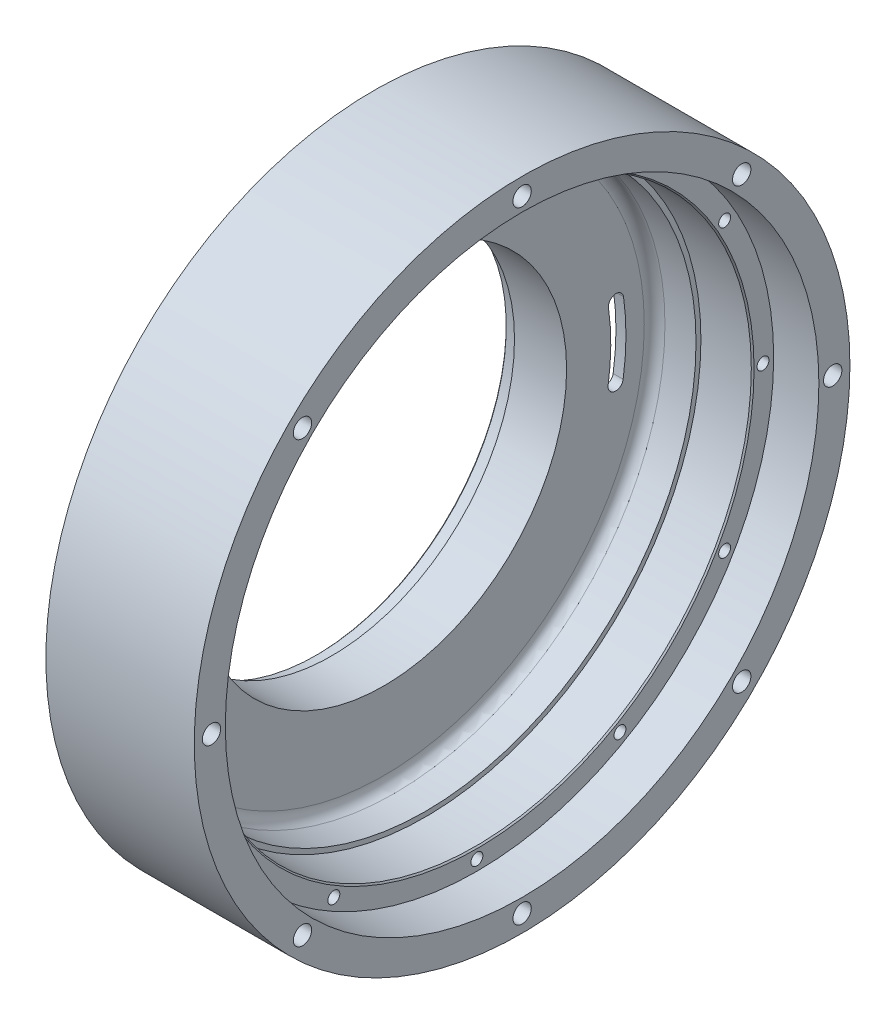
SolidWorks part; units mm, degrees
ref_plane "Front Plane" through (0, 0, 0) normal (0, 0, 1) x (1, 0, 0)
ref_plane "Top Plane" through (0, 0, 0) normal (0, 1, 0) x (1, 0, 0)
ref_plane "Right Plane" through (0, 0, 0) normal (1, 0, 0) x (0, 0, -1)
sketch "Sketch1" plane through (0, 0, 0) normal (1, 0, 0) x (0, 0, -1)
  circle A0 centre (0, 0) radius 120.65
  dimension "D1" = 241.3
extrude "Boss-Extrude1" add sketch "Sketch1" along normal blind 54.61
sketch "Sketch2" plane through (54.61, 0, 0) normal (1, 0, 0) x (0, 0, -1)
  circle A0 centre (0, 0) radius 67.31
  dimension "D1" = 134.62
extrude "Cut-Extrude1" cut sketch "Sketch2" against normal through all
sketch "Sketch3" plane through (54.61, 0, 0) normal (1, 0, 0) x (0, 0, -1)
  circle A0 centre (0, 0) radius 99.695
  dimension "D1" = 199.39
extrude "Cut-Extrude2" cut sketch "Sketch3" against normal blind 50.927
sketch "Sketch4" plane through (54.61, 0, 0) normal (1, 0, 0) x (0, 0, -1)
  circle A0 centre (0, 0) radius 101.4984
  dimension "D1" = 202.9968
extrude "Cut-Extrude3" cut sketch "Sketch4" against normal blind 35.687
sketch "Sketch5" plane through (54.61, 0, 0) normal (1, 0, 0) x (0, 0, -1)
  circle A0 centre (0, 0) radius 109.22
extrude "Cut-Extrude4" cut sketch "Sketch5" against normal blind 16.637
hole_wizard "Tapped Hole for #8-32 Helicoil1" positions "Sketch8" profile "Sketch9" tap size "#8-32" standard "Helicoil® Inch"
sketch "Sketch8" plane through (37.973, 0, 0) normal (1, 0, 0) x (0, 0, -1)
  point P0 (0, 105.283)
  point P4 (0, 105.283)
  dimension "D1" = 105.283
sketch "Sketch9" plane through (37.973, 105.283, 0) normal (0, 1, 0) x (0, 0, -1)
  line L0 (0, 0) -> (0, 16.8396)
  line L1 (0, 16.8396) -> (2.1971, 15.5194)
  line L2 (2.1971, 15.5194) -> (2.1971, 0)
  line L5 (2.1971, 0) -> (0, 0)
  line L10 (0, 16.8396) -> (-2.1971, 15.5194) construction
  line L11 (0, -6.35) -> (0, 107.95) construction
  dimension "Tap Drill Dia." = 4.3942
  dimension "Tap Drill Depth" = 15.5194
  dimension "Drill Angle" = 118
pattern_circular "CirPattern1" count 12 over 360 about axis through (0, 0, 0) along (1, 0, 0) of "Tapped Hole for #8-32 Helicoil1"
sketch "Sketch10" plane through (0, 0, 0) normal (-1, 0, 0) x (0, 0, 1)
  circle A0 centre (0, 0) radius 76.2
  dimension "D1" = 152.4
extrude "Boss-Extrude2" add sketch "Sketch10" along normal blind 21.59
sketch "Sketch11" plane through (-21.59, 0, 0) normal (-1, 0, 0) x (0, 0, 1)
  circle A0 centre (0, 0) radius 67.31
  dimension "D1" = 134.62
extrude "Cut-Extrude5" cut sketch "Sketch11" against normal through all
sketch "Sketch12" plane through (-21.59, 0, 0) normal (-1, 0, 0) x (0, 0, 1)
  circle A0 centre (0, 0) radius 69.8627
  dimension "D1" = 139.7254
extrude "Cut-Extrude6" cut sketch "Sketch12" against normal blind 6.096
hole_wizard "Tapped Hole for #8-32 Helicoil2" positions "Sketch13" profile "Sketch14" tap size "#8-32" standard "Helicoil® Inch"
sketch "Sketch13" plane through (-21.59, 0, 0) normal (-1, 0, 0) x (0, 0, 1)
  circle A0 centre (0, 0) radius 67.31 construction
  point P0 (0, 72.898)
  point P5 (0, 72.898)
  point P7 (0, 72.898)
  point P11 (0, 72.898)
  point P13 (0, 72.898)
  point P15 (0, 72.898)
  dimension "D1" = 72.898
sketch "Sketch14" plane through (-21.59, 72.898, 0) normal (0, 1, 0) x (0, 0, 1)
  line L0 (0, 0) -> (0, 16.8396)
  line L1 (0, 16.8396) -> (2.1971, 15.5194)
  line L2 (2.1971, 15.5194) -> (2.1971, 0)
  line L5 (2.1971, 0) -> (0, 0)
  line L10 (0, 16.8396) -> (-2.1971, 15.5194) construction
  line L11 (0, -6.35) -> (0, 107.95) construction
  dimension "Tap Drill Dia." = 4.3942
  dimension "Tap Drill Depth" = 15.5194
  dimension "Drill Angle" = 118
pattern_circular "CirPattern2" count 8 over 360 about axis through (0, 0, 0) along (1, 0, 0) of "Tapped Hole for #8-32 Helicoil2"
sketch "Sketch16" plane through (0, 0, 0) normal (-1, 0, 0) x (0, 0, 1)
  arc A0 (-85.3519, -13.1568) -> (-85.4877, 12.2432) centre (0, 0) cw construction
  arc A1 (-88.2535, 12.6393) -> (-88.1133, -13.5824) centre (0, 0) ccw
  arc A2 (-82.722, 11.8471) -> (-82.5905, -12.7311) centre (0, 0) ccw
  arc A3 (-82.722, 11.8471) -> (-88.2535, 12.6393) centre (-85.4877, 12.2432) ccw
  arc A4 (-88.1133, -13.5824) -> (-82.5905, -12.7311) centre (-85.3519, -13.1568) ccw
  point P4 (-86.3588, -0.4618)
  dimension "D1" = 86.36
  dimension "D2" = 83.566
  dimension "D3" = 25.4
extrude "Cut-Extrude7" cut sketch "Sketch16" against normal through all
hole_wizard "Tapped Hole for 1/4-20 Helicoil1" positions "Sketch17" profile "Sketch18" tap size "1/4-20" standard "Helicoil® Inch"
sketch "Sketch17" plane through (54.61, 0, 0) normal (1, 0, 0) x (0, 0, -1)
  point P0 (114.3, 0)
  dimension "D1" = 114.3
sketch "Sketch18" plane through (54.61, 0, -114.3) normal (0, 1, 0) x (0, 0, -1)
  line L0 (0, 0) -> (0, 25.9312)
  line L1 (0, 25.9312) -> (3.3782, 23.9014)
  line L2 (3.3782, 23.9014) -> (3.3782, 0)
  line L5 (3.3782, 0) -> (0, 0)
  line L10 (0, 25.9312) -> (-3.3782, 23.9014) construction
  line L11 (0, -6.35) -> (0, 107.95) construction
  dimension "Tap Drill Dia." = 6.7564
  dimension "Tap Drill Depth" = 23.9014
  dimension "Drill Angle" = 118
pattern_circular "CirPattern3" count 8 over 360 about axis through (0, 0, 0) along (1, 0, 0) of "Tapped Hole for 1/4-20 Helicoil1"
hole_wizard "Tapped Hole for 1/4-20 Helicoil2" positions "Sketch19" profile "Sketch20" tap size "1/4-20" standard "Helicoil® Inch"
sketch "Sketch19" plane through (0, 0, 0) normal (-1, 0, 0) x (0, 0, 1)
  point P0 (-114.3, 0)
  dimension "D1" = 114.3
sketch "Sketch20" plane through (0, 0, -114.3) normal (0, 1, 0) x (0, 0, 1)
  line L0 (0, 0) -> (0, 25.9312)
  line L1 (0, 25.9312) -> (3.3782, 23.9014)
  line L2 (3.3782, 23.9014) -> (3.3782, 0)
  line L5 (3.3782, 0) -> (0, 0)
  line L10 (0, 25.9312) -> (-3.3782, 23.9014) construction
  line L11 (0, -6.35) -> (0, 107.95) construction
  dimension "Tap Drill Dia." = 6.7564
  dimension "Tap Drill Depth" = 23.9014
  dimension "Drill Angle" = 118
pattern_circular "CirPattern4" count 8 over 360 about axis through (0, 0, 0) along (1, 0, 0) of "Tapped Hole for 1/4-20 Helicoil2"
fillet "Fillet3" radius 3.81 1 edges at (3.683, 0, -99.695)
chamfer "Chamfer1" distance 0.508 angle 45 1 edges at (-21.59, 0, 69.8627)
chamfer "Chamfer2" distance 0.508 angle 45 1 edges at (37.973, 0, -101.4984)
